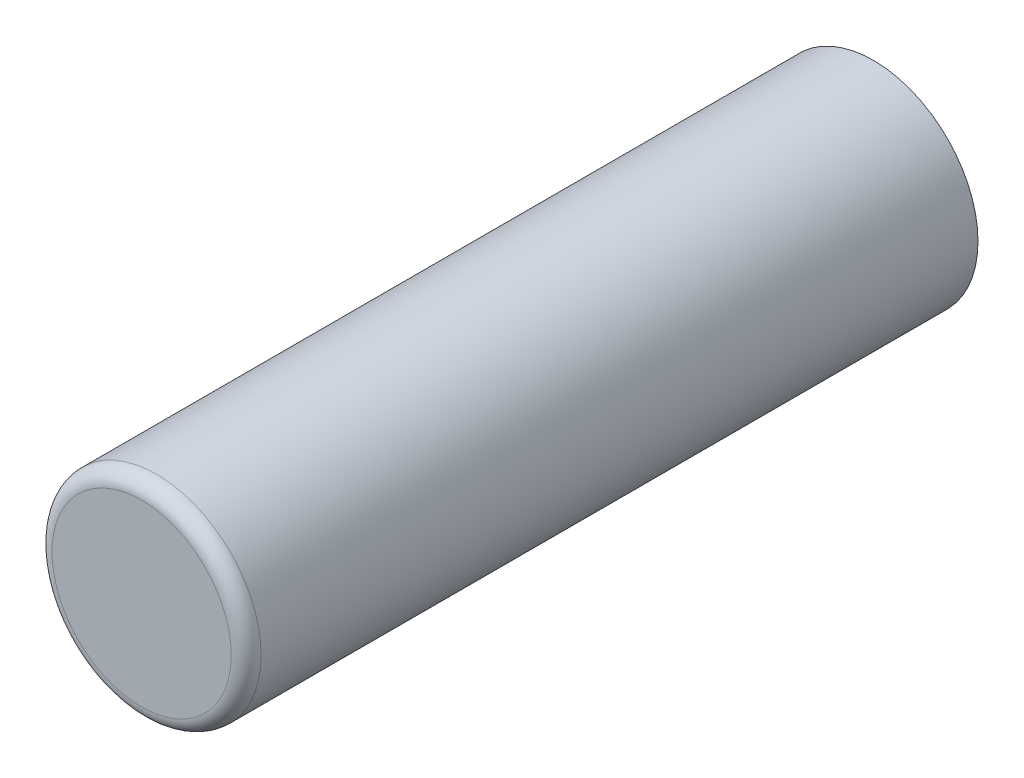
SolidWorks part; units mm, degrees
ref_plane "Ebene vorne" through (0, 0, 0) normal (0, 0, 1) x (1, 0, 0)
ref_plane "Ebene oben" through (0, 0, 0) normal (0, 1, 0) x (1, 0, 0)
ref_plane "Ebene rechts" through (0, 0, 0) normal (1, 0, 0) x (0, 0, -1)
sketch "Skizze1" plane through (0, 0, 0) normal (0, 0, 1) x (1, 0, 0)
  circle A0 centre (0, 0) radius 3.5
  dimension "D1" = 7
extrude "Aufsatz-Linear austragen1" add sketch "Skizze1" along normal blind 24.5 contours A0
fillet "Verrundung1" radius 0.5 1 edges at (3.5, 0, 24.5)
